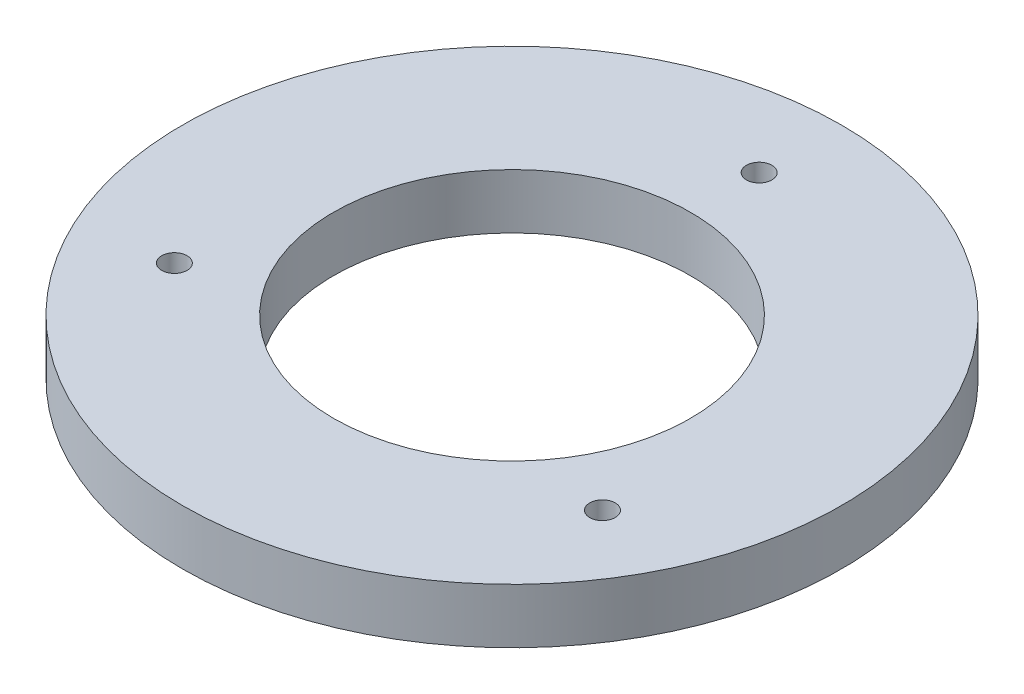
SolidWorks part; units mm, degrees
ref_plane "Front Plane" through (0, 0, 0) normal (0, 0, 1) x (1, 0, 0)
ref_plane "Top Plane" through (0, 0, 0) normal (0, 1, 0) x (1, 0, 0)
ref_plane "Right Plane" through (0, 0, 0) normal (1, 0, 0) x (0, 0, -1)
sketch "Sketch1" plane through (0, 0, 0) normal (0, 1, 0) x (1, 0, 0)
  circle A0 centre (0, 0) radius 38.1
  circle A1 centre (0, 0) radius 28.575 construction
  circle A2 centre (0, 28.575) radius 1.4732
  circle A3 centre (24.7467, -14.2875) radius 1.4732
  circle A4 centre (-24.7467, -14.2875) radius 1.4732
  circle A5 centre (0, 0) radius 20.6375
  point P12 (0, 0)
  dimension "D1" = 76.2
  dimension "D2" = 57.15
  dimension "D3" = 2.9464
  dimension "D5" = 41.275
  dimension "D4" = 3
extrude "Boss-Extrude1" add sketch "Sketch1" along normal blind 6.35
